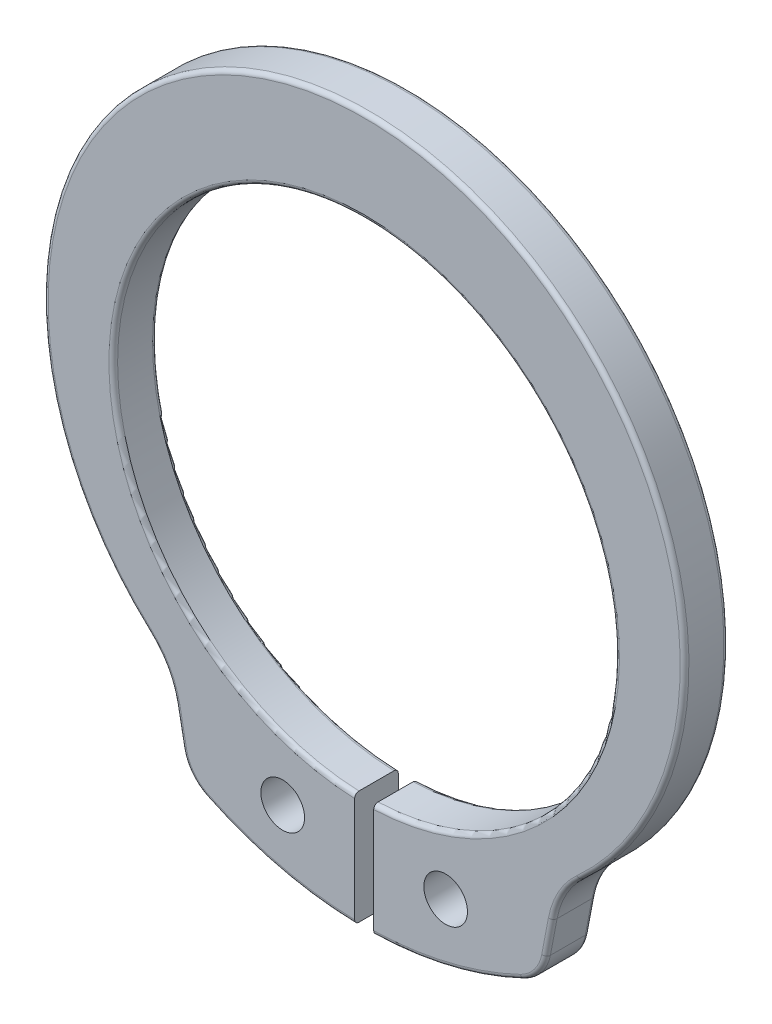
SolidWorks part; units mm, degrees
ref_plane "Front" through (0, 0, 0) normal (0, 0, 1) x (1, 0, 0)
ref_plane "Top" through (0, 0, 0) normal (0, 1, 0) x (1, 0, 0)
ref_plane "Right" through (0, 0, 0) normal (1, 0, 0) x (0, 0, -1)
sketch "Sketch1" plane through (0, 0, 0) normal (0, 0, 1) x (1, 0, 0)
  line L1 (0, 10.6045) -> (0, -10.6045) construction
  line L2 (-5.1764, -9.2595) -> (-5.6561, -6.743) construction
  line L4 (-5.6561, -6.743) -> (-6.4233, -7.6576) construction
  line L5 (-5.6561, -6.743) -> (0, 0) construction
  line L6 (0, 7.3025) -> (0, 9.9949) construction
  line L7 (0, 9.9949) -> (0, 8.6487) construction
  line L8 (0, -7.3025) -> (0, -10.6045) construction
  line L9 (-2.8087, -10.2295) -> (0, 0) construction
  line L10 (0, 0) -> (-0.2777, -10.6045) construction
  line L11 (-5.1764, -9.2595) -> (0, 0) construction
  line L14 (-1.9335, -7.0419) -> (-2.8087, -10.2295) construction
  line L15 (-2.3711, -8.6357) -> (-1.7588, -8.8038) construction
  arc A0 (0, 9.9949) -> (-5.6561, -6.743) centre (0, 0.6703) ccw construction
  circle A2 centre (0, 0) radius 9.9949 construction
  arc A3 (-5.1764, -9.2595) -> (-0.2777, -10.6045) centre (0, 0) ccw construction
  circle A4 centre (0, 0) radius 7.3025 construction
  circle A6 centre (-2.3711, -8.6357) radius 0.635 construction
  point P1 (-4.693, -5.5948)
sketch "Sketch2" plane through (0, 0, 0) normal (0, 1, 0) x (1, 0, 0)
  line L0 (-9.3005, 0.635) -> (-9.3005, -0.635) construction
  point P3 (-9.3005, 0)
sketch "Sketch3" plane through (0, 0, 0) normal (0, 0, 1) x (1, 0, 0)
  line L0 (-5.1764, -9.2595) -> (-5.6561, -6.743) construction
  line L1 (-5.1764, -9.2595) -> (-5.6561, -6.743)
  line L2 (0, 9.9949) -> (0, 7.3025)
  line L3 (-0.2777, -10.6045) -> (-0.2777, -7.2972)
  arc A0 (0, 9.9949) -> (-5.6561, -6.743) centre (0, 0.6703) ccw construction
  arc A1 (-5.1764, -9.2595) -> (-0.2777, -10.6045) centre (0, 0) ccw construction
  circle A2 centre (-2.3711, -8.6357) radius 0.635 construction
  arc A4 (0, 9.9949) -> (-5.6561, -6.743) centre (0, 0.6703) ccw
  arc A5 (-5.1764, -9.2595) -> (-0.2777, -10.6045) centre (0, 0) ccw
  circle A6 centre (-2.3711, -8.6357) radius 0.635
  circle A7 centre (0, 0) radius 7.3025 construction
  arc A8 (0, 7.3025) -> (-0.2777, -7.2972) centre (0, 0) ccw
extrude "Boss-Extrude1" add sketch "Sketch3" along normal mid plane 1.27
fillet "Fillet1" radius 2.54 1 edges at (-5.6561, -6.743, 0)
fillet "Fillet2" radius 1.27 1 edges at (-5.1764, -9.2595, 0)
mirror "Mirror1" about plane through (0, 9.9949, 0.635) normal (-1, 0, 0)
fillet "Fillet3" radius 0.127 20 edges at (-2.4911, -10.3115, 0.635) (-2.4911, -10.3115, -0.635) (-5.0508, -9.1913, 0.635) (-5.0508, -9.1913, -0.635) (-5.3891, -8.1437, -0.635) (-5.3891, -8.1437, 0.635) (-5.7656, -6.8669, 0.635) (-5.7656, -6.8669, -0.635) (0, 9.9949, -0.635) (0, 9.9949, 0.635) (5.7656, -6.8669, -0.635) (2.4911, -10.3115, -0.635) (5.0508, -9.1913, -0.635) (2.4911, -10.3115, 0.635) (5.0508, -9.1913, 0.635) (5.3891, -8.1437, 0.635) (5.7656, -6.8669, 0.635) (5.3891, -8.1437, -0.635) (0, 7.3025, -0.635) (0, 7.3025, 0.635)
sketch "Sketch4" plane through (0, 0, 0) normal (0, 0, 1) x (1, 0, 0)
  line L1 (-6.3242, -3.6513) -> (0, 0) construction
  line L2 (0, 10.6045) -> (0, -10.6045) construction
  circle A0 centre (0, 0) radius 7.3025 construction
  point P0 (-6.3242, -3.6513)
  dimension "D1" = 60
equation "\"D1@Boss-Extrude1\" = \"Ring Thickness@Sketch2\""
equation "\"D1@Sketch1\"=\"Hole Diameter@Sketch1\"*4"
equation "\"D1@Fillet1\"=\"Hole Diameter@Sketch1\"*2"
equation "\"D1@Fillet2\"=\"D1@Fillet1\"*.5"
equation "\"D1@Fillet3\"=\"Hole Diameter@Sketch1\"*.1"
